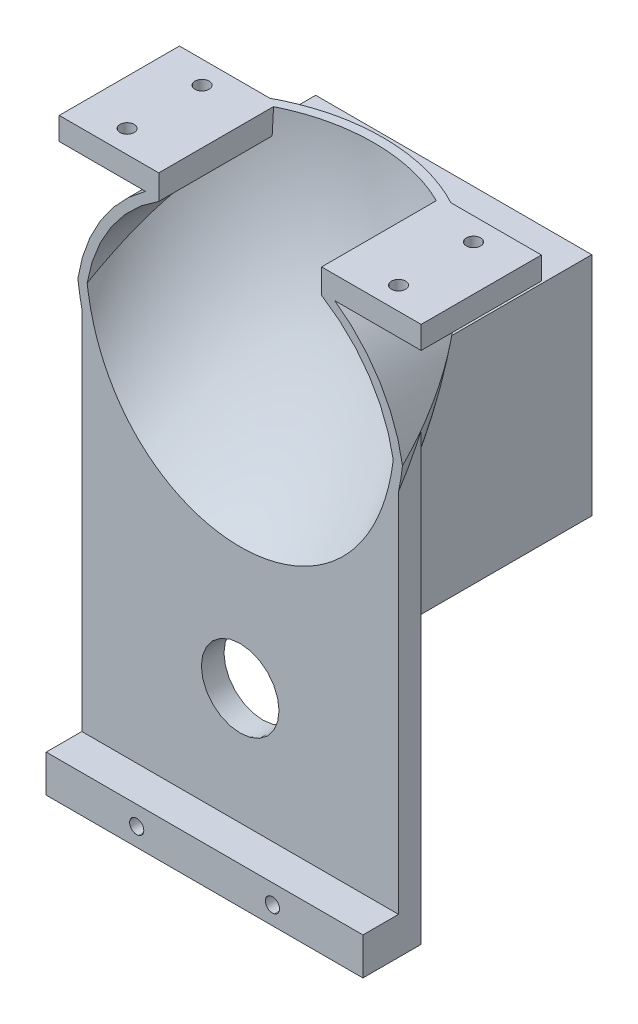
SolidWorks part; units mm, degrees
other "Markup1"
sketch "Sketch24" plane through (-51.5286, 177.8, 76.2) normal (-0.8191, 0.3143, 0.4799) x (-0.3836, -0.9221, -0.0508)
ref_plane "Front Plane" through (0, 0, 0) normal (0, 0, 1) x (1, 0, 0)
ref_plane "Top Plane" through (0, 0, 0) normal (0, 1, 0) x (1, 0, 0)
ref_plane "Right Plane" through (0, 0, 0) normal (1, 0, 0) x (0, 0, -1)
sketch "Sketch1" plane through (0, 0, 0) normal (0, 0, 1) x (1, 0, 0)
  line L0 (-25.4, -80.1) -> (-10, -80.1) construction
  line L2 (-25.4, -38.4714) -> (-25.4, -113.05)
  line L3 (-25.4, -113.05) -> (25.4, -113.05)
  line L4 (25.4, -38.4714) -> (25.4, -113.05)
  line L5 (-10, -59.85) -> (10, -59.85)
  line L6 (-10, -59.85) -> (-10, -100.35)
  line L7 (-10, -100.35) -> (10, -100.35)
  line L8 (10, -59.85) -> (10, -100.35)
  line L9 (10, -80.1) -> (25.4, -80.1) construction
  line L10 (0, -69.85) -> (-10, -69.85) construction
  line L11 (0, -69.85) -> (10, -69.85) construction
  arc A0 (25.4, -38.4714) -> (-25.4, -38.4714) centre (0, 0) ccw
  circle A1 centre (0, 0) radius 38.1
  point P13 (0, -69.85)
  point P14 (-10, -80.1)
  dimension "D1" = 8
  dimension "D2" = 76.2
  dimension "D3" = 69.85
  dimension "D4" = 10
  dimension "D6" = 40.5
  dimension "D8" = 12.7
  dimension "D5" = 50.8
  dimension "D7" = 20
extrude "Boss-Extrude1" add sketch "Sketch1" along normal blind 76.2
sketch "Sketch2" plane through (0, 0, 0) normal (1, 0, 0) x (0, 0, -1)
  line L0 (-71.8569, -1.8031) -> (-73.66, 0)
  line L1 (-73.66, 0) -> (-71.8569, 1.8031)
  line L3 (-76.2, 38.1) -> (-76.2, -38.1) construction
  arc A0 (-71.8569, -1.8031) -> (-71.8569, 1.8031) centre (-70.0538, 0) ccw
  dimension "D1" = 5.1
  dimension "D2" = 90
  dimension "D3" = 2.54
extrude "Cut-Extrude1" cut sketch "Sketch2" against normal through all both and the other way through all contours A0 L1 L0
ref_plane "Plane1" through (46.1, 0, 0) normal (1, 0, 0) x (0, 0, -1)
sketch "Sketch3" plane through (46.1, 0, 0) normal (1, 0, 0) x (0, 0, -1)
  line L0 (-71.8569, -1.8031) -> (-73.66, 0) construction
  line L1 (-73.66, 0) -> (-71.8569, 1.8031) construction
  line L2 (-71.8569, -1.8031) -> (-73.66, 0)
  line L3 (-73.66, 0) -> (-71.8569, 1.8031)
  line L4 (-74.2257, 0) -> (-72.1397, 2.086)
  line L5 (-72.1397, -2.086) -> (-74.2257, 0)
  arc A0 (-71.8569, -1.8031) -> (-71.8569, 1.8031) centre (-70.0538, 0) ccw construction
  arc A1 (-71.8569, -1.8031) -> (-71.8569, 1.8031) centre (-70.0538, 0) ccw
  arc A2 (-72.1397, -2.086) -> (-72.1397, 2.086) centre (-70.0538, 0) ccw
  dimension "D1" = 0.4
extrude "Cut-Extrude2" cut sketch "Sketch3" against normal blind 1
mirror "Mirror1" about plane through (0, 0, 0) normal (1, 0, 0) of "Cut-Extrude2"
sketch "Sketch4" plane through (0, 0, 76.2) normal (0, 0, 1) x (1, 0, 0)
  line L0 (-25.4, -113.05) -> (25.4, -113.05) construction
  line L2 (-25.4, -38.4714) -> (-25.4, -113.05)
  line L3 (-25.4, -113.05) -> (25.4, -113.05)
  line L4 (25.4, -38.4714) -> (25.4, -113.05)
  arc A0 (-25.4, -38.4714) -> (25.4, -38.4714) centre (0, 0) ccw
  arc A1 (25.4, -38.4714) -> (-25.4, -38.4714) centre (0, 0) ccw construction
extrude "Cut-Extrude3" cut sketch "Sketch4" against normal offset from surface 13.9 and the other way through all
ref_plane "Plane2" through (0, 46.1, 0) normal (0, 1, 0) x (1, 0, 0)
ref_plane "Plane3" through (0, 173.1, 0) normal (0, 1, 0) x (1, 0, 0)
sketch "Sketch9" plane through (0, 173.1, 0) normal (0, 1, 0) x (1, 0, 0)
  line L0 (-25.4, 53.34) -> (25.4, 53.34)
  line L1 (25.4, 53.34) -> (25.4, 27.94)
  line L2 (25.4, 27.94) -> (-25.4, 27.94) construction
  line L3 (-25.4, 27.94) -> (-25.4, 53.34)
  line L4 (0, 0) -> (0, 27.94) construction
  line L5 (-46.1, -76.2) -> (46.1, -76.2) construction
  arc A0 (-25.4, 27.94) -> (25.4, 27.94) centre (0, 27.94) ccw
  point P8 (0, 27.94)
  dimension "D2" = 25.4
  dimension "D1" = 50.8
  dimension "D3" = 129.54
sketch3d "3DSketch2"
  line L0 (0, 173.1, -27.94) -> (0, 74.1819, -27.94)
  line L1 (25.4, 173.1, -27.94) -> (-25.4, 173.1, -27.94) construction
  line L2 (0, 53.7227, -23.638) -> (0, 0, 0)
  arc A0 (0, 74.1819, -27.94) -> (0, 53.7227, -23.638) centre (0, 74.1819, 22.86) ccw
  point P8 (0, 0, -27.94)
  point P13 (0, 63.5, -27.94)
  point P14 (-50.8, 74.1819, 22.86)
  dimension "D1" = 63.5
  dimension "D2" = 50.8
extrude "Boss-Extrude3" add sketch "Sketch9" against normal up to surface (127 mm away) separate body contours L0 L1 A0 L3
sketch "Sketch18" plane through (0, 46.1, 0) normal (0, -1, 0) x (1, 0, 0)
  line L0 (25.4, -53.34) -> (-25.4, -53.34) construction
  line L1 (25.4, -27.94) -> (25.4, -53.34) construction
  line L2 (-25.4, -53.34) -> (-25.4, -27.94) construction
  line L3 (25.4, -53.34) -> (-25.4, -53.34)
  line L4 (25.4, -27.94) -> (25.4, -53.34)
  line L5 (-25.4, -53.34) -> (-25.4, -27.94)
  arc A0 (25.4, -27.94) -> (-25.4, -27.94) centre (0, -27.94) ccw construction
  arc A1 (25.4, -27.94) -> (-25.4, -27.94) centre (0, -27.94) ccw
sketch "Sketch19" plane through (0, 0, 0) normal (1, 0, 0) x (0, 0, -1)
  line L0 (0, -113.05) -> (0, -38.4714) construction
  line L1 (53.34, 46.1) -> (53.34, 173.1) construction
  line L2 (53.34, 46.1) -> (27.94, 46.1) construction
  arc A0 (0, -49.962) -> (53.34, 46.1) centre (-59.8308, 46.1) ccw
sketch "Sketch20" plane through (0, 0, 0) normal (0, 0, -1) x (-1, 0, 0)
  circle A0 centre (0, 0) radius 46.1
  arc A1 (25.4, -38.4714) -> (-25.4, -38.4714) centre (0, 0) ccw construction
sweep "Sweep2" add profiles "Sketch20" path "Sketch19"
sketch "Sketch21" plane through (0, 173.1, 0) normal (0, 1, 0) x (1, 0, 0)
  line L0 (-25.4, 53.34) -> (-25.4, 27.94)
  line L1 (-25.4, 27.94) -> (25.4, 27.94) construction
  line L2 (25.4, 27.94) -> (25.4, 53.34)
  line L3 (25.4, 53.34) -> (-25.4, 53.34)
  arc A0 (-25.4, 27.94) -> (25.4, 27.94) centre (0, 27.94) ccw
  circle A1 centre (0, 27.94) radius 101.6
  dimension "D1" = 203.2
extrude "Cut-Extrude4" cut sketch "Sketch21" against normal offset from surface (114.3 mm away) 12.7
sketch "Sketch22" plane through (0, 0, 76.2) normal (0, 0, 1) x (1, 0, 0)
  line L0 (-25.4, 38.4714) -> (-25.4, 173.1)
  line L1 (-25.4, 58.8) -> (-25.4, 173.1) construction
  line L2 (25.4, 38.4714) -> (25.4, 173.1)
  line L3 (25.4, 58.8) -> (25.4, 173.1) construction
  line L4 (25.4, 173.1) -> (-25.4, 173.1)
  line L5 (41.91, 173.1) -> (-41.91, 173.1) construction
  line L6 (25.4, -38.4714) -> (25.4, -113.05)
  line L7 (25.4, -113.05) -> (-25.4, -113.05)
  line L8 (-25.4, -113.05) -> (-25.4, -38.4714)
  line L9 (-25.4, -113.05) -> (-25.4, -38.4714) construction
  line L10 (25.4, -38.4714) -> (25.4, -113.05) construction
  line L11 (25.4, -113.05) -> (-25.4, -113.05) construction
  arc A0 (-25.4, 38.4714) -> (-25.4, -38.4714) centre (0, 0) ccw
  circle A1 centre (0, 0) radius 46.1 construction
  arc A2 (25.4, -38.4714) -> (25.4, 38.4714) centre (0, 0) ccw
extrude "Cut-Extrude6" cut sketch "Sketch22" against normal through all flip side to cut
fillet "Fillet1" radius 12.7 1 edges at (0, 46.1, -53.34)
shell "Shell8" thickness 2.54
ref_plane "Plane4" through (0, 0, -9) normal (0, 0, -1) x (-1, 0, 0)
sketch "Sketch29" plane through (0, -113.05, 0) normal (0, -1, 0) x (-1, 0, 0)
  line L1 (44.45, 10) -> (-44.45, 10)
  line L2 (44.45, 10) -> (44.45, 16.35)
  line L3 (44.45, 16.35) -> (-44.45, 16.35)
  line L4 (-44.45, 10) -> (-44.45, 16.35)
  line L5 (0, 23.638) -> (0, 0) construction
  line L6 (56.089, 9) -> (-56.089, 9) construction
  dimension "D1" = 6.35
  dimension "D2" = 44.45
  dimension "D3" = 44.45
  dimension "D4" = 1
ref_plane "Plane5" through (0, 0, 63.5) normal (0, 0, 1) x (1, 0, 0)
extrude "Boss-Extrude4" add sketch "Sketch29" against normal up to surface (113.2699 mm away) contours L3 L4 L1 L2
sketch "Sketch44" plane through (0, 0, -16.35) normal (0, 0, -1) x (-1, 0, 0)
  circle A0 centre (0, -69.85) radius 10.9
  point P0 (0, -69.85)
  dimension "D1" = 21.8
extrude "Cut-Extrude20" cut sketch "Sketch44" against normal up to surface (6.35 mm away)
sketch "Sketch45" plane through (0, 58.8, 0) normal (0, 1, 0) x (1, 0, 0)
  line L3 (-25.4, -5.3128) -> (25.4, -5.3128)
  line L4 (25.4, 1.0372) -> (25.4, -5.3128)
  line L5 (-25.4, 27.94) -> (-25.4, -0.8678) construction
  line L6 (-25.4, 1.0372) -> (25.4, 1.0372)
  line L7 (25.4, -0.8678) -> (25.4, 27.94) construction
  line L8 (-25.4, 1.0372) -> (-25.4, -5.3128)
  dimension "D1" = 1.905
  dimension "D2" = 6.35
extrude "Boss-Extrude7" add sketch "Sketch45" against normal offset from surface (18.8155 mm away) 1.27
sketch "Sketch46" plane through (0, 58.8, 0) normal (0, 1, 0) x (1, 0, 0)
  line L0 (-44.45, -4.0428) -> (-46.1, -4.0428) construction
  line L1 (-44.45, -4.0428) -> (44.45, -4.0428)
  line L2 (-44.45, -4.0428) -> (-44.45, -69.85)
  line L3 (-44.45, -69.85) -> (44.45, -69.85)
  line L4 (44.45, -4.0428) -> (44.45, -69.85)
  line L5 (-46.1, 0) -> (-46.1, -67.1038) construction
  line L6 (-46.1, -76.2) -> (46.1, -76.2) construction
  line L7 (-25.4, -5.3128) -> (25.4, -5.3128) construction
  line L9 (44.45, -4.0428) -> (46.1, -4.0428) construction
  line L11 (46.1, -80.4214) -> (46.1, 80.4214) construction
  dimension "D1" = 6.35
  dimension "D2" = 1.27
  dimension "D3" = 88.9
extrude "Boss-Extrude10" add sketch "Sketch46" against normal offset from surface (6.35 mm away) 6.35
sketch "Sketch43" plane through (0, 0, -10) normal (0, 0, 1) x (1, 0, 0)
  circle A0 centre (0, 0) radius 48.64
  circle A1 centre (0, 0) radius 46.1 construction
  dimension "D1" = 2.54
extrude "Cut-Extrude19" cut sketch "Sketch43" along normal blind 10
sketch "Sketch49" plane through (25.4, 0, 0) normal (1, 0, 0) x (0, 0, -1)
  line L0 (0, 46.1) -> (0, -38.4714) construction
  line L1 (0, 44.0212) -> (10, 44.0212)
  line L2 (0, 44.0212) -> (0, 41.2272)
  line L3 (0, 41.2272) -> (10, 41.2272)
  line L4 (10, 44.0212) -> (10, 41.2272)
  line L5 (10, 38.4714) -> (10, 41.4812) construction
  line L6 (10, 41.4812) -> (0, 41.4812) construction
  dimension "D1" = 0.254
  dimension "D2" = 2.54
extrude "Cut-Extrude21" cut sketch "Sketch49" against normal through all both and the other way through all
sketch "Sketch50" plane through (0, 0, 13.9) normal (0, 0, 1) x (1, 0, 0)
  line L0 (10, -59.85) -> (10, -100.35) construction
  line L1 (-5, -56.1) -> (-5, -59.85) construction
  line L2 (-10, -59.85) -> (10, -59.85) construction
  line L3 (-5, -104.1) -> (-5, -100.35) construction
  line L4 (-10, -100.35) -> (10, -100.35) construction
  circle A0 centre (5, -56.1) radius 2
  circle A1 centre (-5, -56.1) radius 2
  circle A2 centre (5, -104.1) radius 2
  circle A3 centre (-5, -104.1) radius 2
  dimension "D1" = 4
  dimension "D2" = 5
  dimension "D3" = 10
  dimension "D4" = 48
extrude "Cut-Extrude22" cut sketch "Sketch50" against normal offset from surface 2.54 and the other way through all
sketch "Sketch51" plane through (-25.4, 0, 0) normal (-1, 0, 0) x (0, 0, 1)
  line L0 (-53.34, 173.1) -> (-48.26, 173.1)
  line L1 (-48.26, 173.1) -> (-43.8251, 46.1)
  line L2 (-43.8251, 46.1) -> (-53.34, 46.1)
  line L3 (-53.34, 173.1) -> (-53.34, 46.1)
  line L4 (-53.34, 46.1) -> (-27.94, 46.1) construction
  dimension "D1" = 2
  dimension "D2" = 5.08
extrude "Boss-Extrude14" add sketch "Sketch51" against normal up to surface (50.8 mm away)
sketch "Sketch54" plane through (0, 0, -10) normal (0, 0, 1) x (1, 0, 0)
  line L0 (44.45, 0.2199) -> (44.45, -113.05) construction
  line L1 (-44.45, -113.05) -> (44.45, -113.05)
  line L2 (-44.45, -113.05) -> (-44.45, -102.5765)
  line L3 (-44.45, -102.5765) -> (44.45, -102.5765)
  line L4 (44.45, -113.05) -> (44.45, -102.5765)
  line L5 (-10, -100.35) -> (10, -100.35) construction
  dimension "D1" = 2.2265
extrude "Boss-Extrude20" add sketch "Sketch54" along normal blind 10.16
sketch "Sketch55" plane through (-25.4, 0, 0) normal (-1, 0, 0) x (0, 0, 1)
  line L1 (-53.34, 173.1) -> (-50.8, 173.1)
  line L2 (-53.34, 173.1) -> (-53.34, 20.7)
  line L3 (-53.34, 20.7) -> (-50.8, 20.7)
  line L4 (-50.8, 173.1) -> (-50.8, 20.7)
  line L5 (-27.94, 173.1) -> (-53.34, 173.1) construction
  dimension "D1" = 2.54
  dimension "D2" = 152.4
extrude "Cut-Extrude23" cut sketch "Sketch55" against normal through all both and the other way through all
sketch "Sketch57" plane through (0, 0, 76.2) normal (0, 0, 1) x (1, 0, 0)
  circle A0 centre (0, 0) radius 46.1
extrude "Cut-Extrude24" cut sketch "Sketch57" against normal up to surface and the other way through all
sketch "Sketch58" plane through (25.4, 0, 0) normal (1, 0, 0) x (0, 0, -1)
  line L0 (-13.9, -113.05) -> (0, -113.05) construction
  line L1 (0, -113.05) -> (-13.9, -113.05)
  line L2 (0, -113.05) -> (0, -38.4714)
  line L3 (0, -38.4714) -> (-13.9, -38.4714)
  line L4 (-13.9, -113.05) -> (-13.9, -38.4714)
  line L5 (0, -113.05) -> (0, -38.4714) construction
extrude "Cut-Extrude25" cut sketch "Sketch58" against normal through all both and the other way through all
sketch "Sketch59" plane through (0, 0, 0) normal (0, 0, 1) x (1, 0, 0)
  line L0 (-19.05, -107.97) -> (-44.45, -107.97) construction
  line L1 (-44.45, -102.5765) -> (-44.45, -113.05) construction
  line L2 (19.05, -107.97) -> (44.45, -107.97) construction
  line L3 (44.45, -102.5765) -> (44.45, -113.05) construction
  line L4 (-44.45, -113.05) -> (44.45, -113.05) construction
  circle A0 centre (-19.05, -107.97) radius 2
  circle A1 centre (19.05, -107.97) radius 2
  dimension "D1" = 5.08
  dimension "D2" = 4
  dimension "D3" = 38.1
extrude "Cut-Extrude26" cut sketch "Sketch59" against normal up to surface (16.35 mm away)
sketch "Sketch60" plane through (0, 58.8, 0) normal (0, 1, 0) x (1, 0, 0)
  line L0 (-55, -63.5) -> (55, -63.5) construction
  line L1 (-44.45, -4.0428) -> (-44.45, -69.85) construction
  circle A0 centre (38.1, -12.7) radius 2
  circle A1 centre (38.1, -57.15) radius 2
  circle A2 centre (-38.1, -57.15) radius 2
  circle A3 centre (-38.1, -12.7) radius 2
  dimension "D1" = 76.2
  dimension "D3" = 4
  dimension "D2" = 44.45
  dimension "D4" = 6.35
  dimension "D5" = 6.35
extrude "Cut-Extrude27" cut sketch "Sketch60" against normal up to surface (6.35 mm away)
sketch "Sketch61" plane through (25.4, 0, 0) normal (1, 0, 0) x (0, 0, -1)
  line L0 (10, 44.0212) -> (50.8, 44.0212)
  line L1 (50.8, 46.1) -> (50.8, 173.1) construction
  line L2 (10, 44.0212) -> (9, 32.4698)
  line L3 (9, -56.089) -> (9, 56.089) construction
  line L4 (9, 32.4698) -> (-71.376, 32.4698)
  line L5 (-71.376, 32.4698) -> (-71.376, 179.5478)
  line L6 (-71.376, 179.5478) -> (65.3845, 179.5478)
  line L7 (65.3845, 179.5478) -> (65.3845, 44.0212)
  line L8 (65.3845, 44.0212) -> (50.8, 44.0212)
extrude "Cut-Extrude28" cut sketch "Sketch61" against normal through all both and the other way through all
sketch "Sketch62" plane through (0, 44.0212, 0) normal (0, 1, 0) x (1, 0, 0)
  line L0 (44.45, 10) -> (-44.45, 10) construction
  line L1 (25.4, 10) -> (50.8, 10)
  line L2 (25.4, 10) -> (25.4, 43.7439)
  line L3 (25.4, 43.7439) -> (50.8, 43.7439)
  line L4 (50.8, 10) -> (50.8, 43.7439)
  line L5 (22.86, 10) -> (25.4, 10) construction
  line L6 (25.4, 43.4835) -> (25.4, 10) construction
  line L7 (-25.4, 10) -> (-50.8, 10)
  line L8 (-25.4, 10) -> (-25.4, 43.7439)
  line L9 (-25.4, 43.7439) -> (-50.8, 43.7439)
  line L10 (-50.8, 10) -> (-50.8, 43.7439)
  dimension "D1" = 25.4
extrude "Boss-Extrude21" add sketch "Sketch62" against normal blind 6.35
sketch "Sketch63" plane through (0, 44.0212, 0) normal (0, 1, 0) x (1, 0, 0)
  line L0 (-50.8, 10) -> (-22.86, 10) construction
  line L1 (-50.8, 43.7439) -> (-50.8, 10) construction
  line L2 (-25.4, 43.7439) -> (-50.8, 43.7439) construction
  line L3 (50.8, 10) -> (50.8, 43.7439) construction
  circle A0 centre (38.1, 37.3939) radius 2
  circle A1 centre (38.1, 16.35) radius 2
  circle A2 centre (-38.1, 16.35) radius 2
  circle A3 centre (-38.1, 37.3939) radius 2
  dimension "D1" = 4
  dimension "D2" = 6.35
  dimension "D3" = 12.7
  dimension "D4" = 6.35
  dimension "D5" = 12.7
extrude "Cut-Extrude29" cut sketch "Sketch63" against normal up to surface and the other way through all
ref_plane "Plane6" through (0, 0, -69.944) normal (0, 0, -1) x (-1, 0, 0)
sketch "Sketch64" plane through (0, 0, -69.944) normal (0, 0, -1) x (-1, 0, 0)
  line L1 (-38.7511, -38.5288) -> (38.7511, -38.5288)
  line L2 (-38.7511, -38.5288) -> (-38.7511, 24.9712)
  line L3 (-38.7511, 24.9712) -> (38.7511, 24.9712)
  line L4 (38.7511, -38.5288) -> (38.7511, 24.9712)
  line L6 (25.4, 37.6712) -> (50.8, 37.6712) construction
  arc A0 (-26.5724, 37.6712) -> (-45.5606, 7.0315) centre (0, 0) ccw construction
  arc A1 (45.5606, 7.0315) -> (26.5724, 37.6712) centre (0, 0) ccw construction
  point P4 (0, 0)
  point P10 (0, 0)
  point P11 (0, 0)
  dimension "D1" = 12.7
  dimension "D2" = 63.5
extrude "Boss-Extrude22" add sketch "Sketch64" against normal up to next
